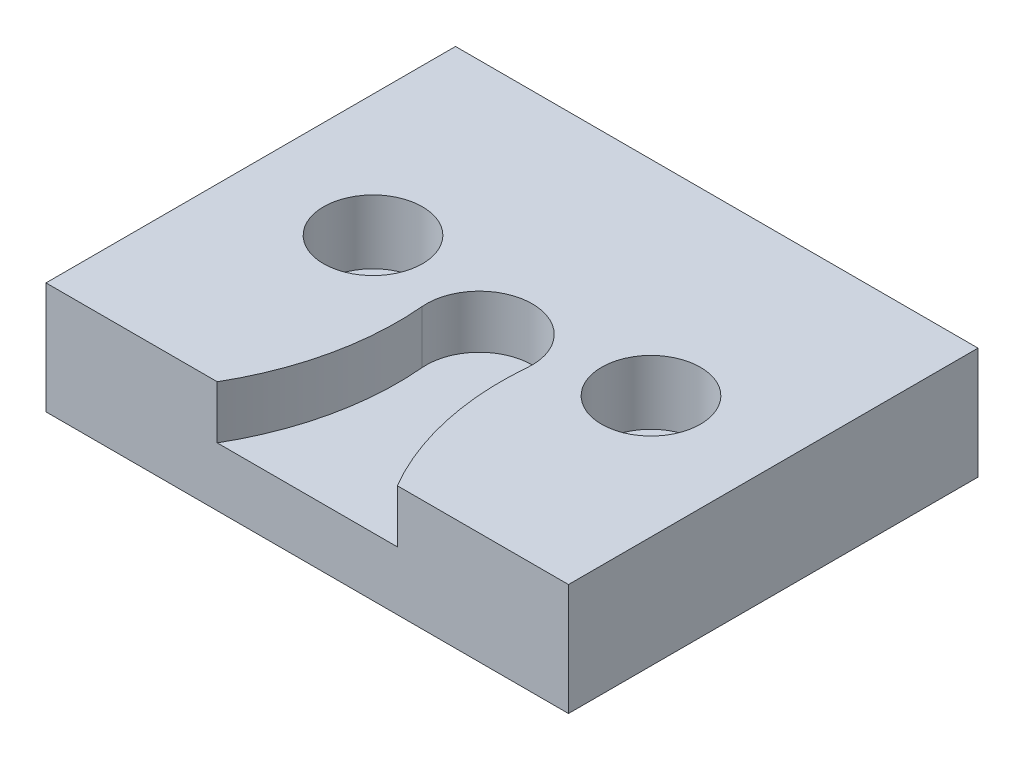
SolidWorks part; units mm, degrees
other "<Soft Jaw A>-<CBORE for 7/16 Socket Head Cap Screw1>"
ref_plane "Front Plane" through (0, 0, 0) normal (0, 0, 1) x (1, 0, 0)
ref_plane "Top Plane" through (0, 0, 0) normal (0, 1, 0) x (1, 0, 0)
ref_plane "Right Plane" through (0, 0, 0) normal (1, 0, 0) x (0, 0, -1)
inserted part "Soft Jaw A"
sketch "Sketch1" plane through (0, 0, 0) normal (0, 1, 0) x (1, 0, 0)
  line L1 (-25.4001, -63.0237) -> (25.4, -63.0237)
  line L2 (-25.4001, -63.0237) -> (25.4, -63.0237)
  arc A5 (25.4, -63.0237) -> (29.2538, -51.6269) centre (25.4, -56.6737) ccw
  arc A6 (-29.2539, -51.6269) -> (-25.4001, -63.0237) centre (-25.4001, -56.6737) ccw
  arc A7 (-29.2539, -51.6269) -> (-9.4871, -6.723) centre (-60.0848, -11.2525) ccw
  arc A8 (9.487, -6.723) -> (-9.4871, -6.723) centre (0, -5.8737) ccw
  arc A9 (9.487, -6.723) -> (29.2538, -51.6269) centre (60.0847, -11.2525) ccw
  arc A10 (25.4, -63.0237) -> (29.2538, -51.6269) centre (25.4, -56.6737) ccw
  arc A11 (-29.2539, -51.6269) -> (-25.4001, -63.0237) centre (-25.4001, -56.6737) ccw
  arc A12 (-29.2539, -51.6269) -> (-9.4871, -6.723) centre (-60.0848, -11.2525) ccw
  arc A13 (9.487, -6.723) -> (-9.4871, -6.723) centre (0, -5.8737) ccw
  arc A14 (9.487, -6.723) -> (29.2538, -51.6269) centre (60.0847, -11.2525) ccw
  dimension "D1" = 0
extrude "Cut-Extrude1" cut sketch "Sketch1" against normal blind 9.525
